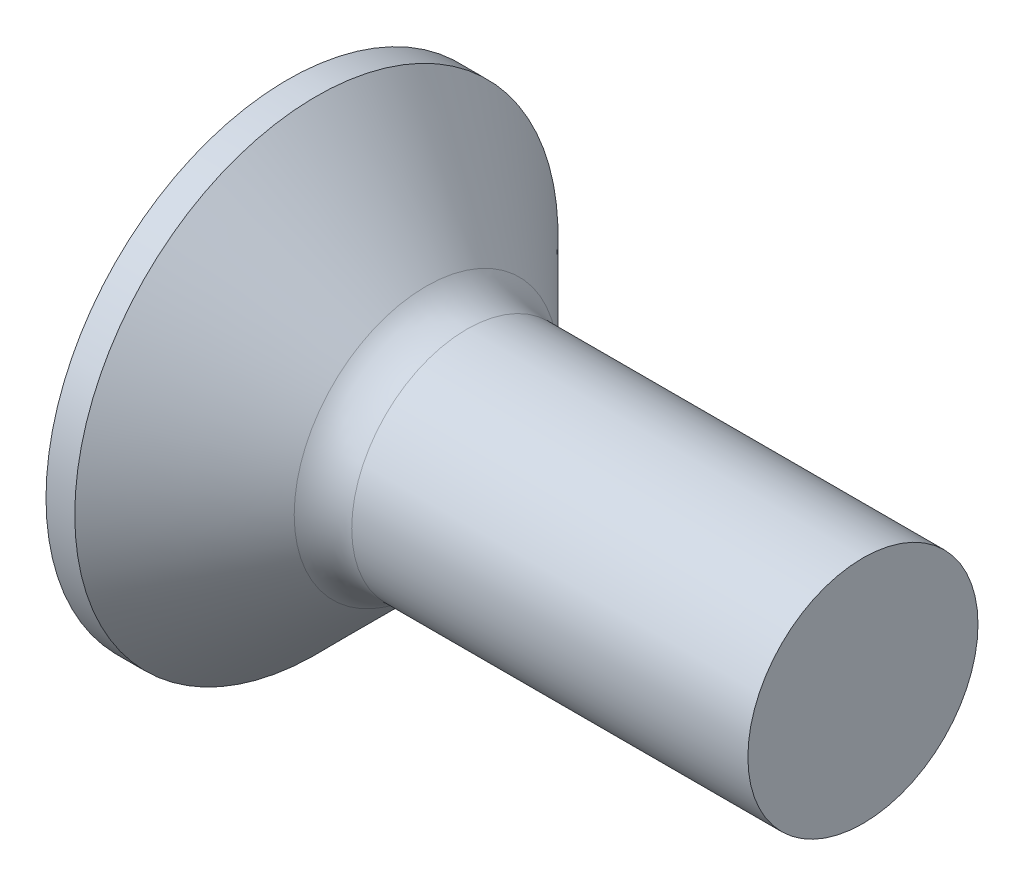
SolidWorks part; units mm, degrees
revolve "Base-Revolve" add sketch "BodySke"
sketch "BodySke" plane through (0, 0, 0) normal (0, 0, 1) x (1, 0, 0)
  line L0 (0, 0) -> (0, 4.2)
  line L1 (0, 4.2) -> (0.5, 4.2)
  line L2 (2.7, 2) -> (10, 2)
  line L3 (10, 2) -> (10, 0)
  line L4 (10, 0) -> (0, 0)
  line L5 (-6.35, 0) -> (82.55, 0) construction
  line L6 (2.7, -2) -> (10, -2) construction
  line L7 (0.5, -4.2) -> (2.7, -2) construction
  line L8 (0.5, 4.2) -> (2.7, 2)
  line L9 (0, -4.2) -> (0.5, -4.2) construction
  line L10 (3.4, 3.5875) -> (3.4, -5.9375) construction
  line L11 (0, 6.35) -> (0, -3.175) construction
fillet "Fillet1" radius 1 1 edges at (2.7, 0, 2)
ref_plane "Plane1" through (0, 0, 0) normal (0, 0, 1) x (1, 0, 0)
ref_plane "Plane2" through (0, 0, 0) normal (0, 1, 0) x (1, 0, 0)
ref_plane "Plane3" through (0, 0, 0) normal (1, 0, 0) x (0, 0, -1)
sketch "Sketch3" plane through (0, 0, 0) normal (-1, 0, 0) x (0, 0, 1)
  line L0 (-0.515, 2.2) -> (0.515, 2.2)
  line L1 (0.515, 2.2) -> (0.515, -2.2)
  line L2 (0.515, -2.2) -> (-0.515, -2.2)
  line L3 (-0.515, -2.2) -> (-0.515, 2.2)
ref_plane "Plane4" through (2.51, 0, 0) normal (-1, 0, 0) x (0, 0, 1)
sketch "Sketch4" plane through (2.51, 0, 0) normal (-1, 0, 0) x (0, 0, 1)
  line L0 (-0.515, 0.9486) -> (0.515, 0.9486)
  line L3 (0.515, 0.9486) -> (0.515, -0.9486)
  line L4 (0.515, -0.9486) -> (-0.515, -0.9486)
  line L5 (-0.515, -0.9486) -> (-0.515, 0.9486)
loft "Recess" cut profiles "Sketch3", "Sketch4"
pattern_circular "RecPat" count 2 every 90 about axis through (0, 0, 0) along (1, 0, 0) of "Recess"
sketch "RecCorSke" plane through (0, 0, 0) normal (0, 0, 1) x (1, 0, 0)
  line L0 (-3.175, 0) -> (15.875, 0) construction
  line L2 (0, 0) -> (0, 1.0265)
  line L3 (0, 1.0265) -> (2.51, 0.851)
  line L4 (2.51, 0.851) -> (2.7865, 0)
  line L5 (2.7865, 0) -> (0, 0)
revolve "RecessCore" cut sketch "RecCorSke" angle 360 about L0
sketch "ThdSchSke" plane through (0, 0, 0) normal (0, 0, 1) x (1, 0, 0)
  line L0 (3.4, -1.61) -> (3.1269, -2)
  line L1 (3.4, -1.61) -> (3.6731, -2)
  line L2 (3.6731, -2) -> (3.6731, -2.5)
  line L3 (-3.175, 0) -> (5.1513, 0) construction
  line L5 (3.6731, -2.5) -> (3.1269, -2.5)
  line L6 (3.1269, -2.5) -> (3.1269, -2)
  line L7 (0, 4.2) -> (0, -4.2) construction
revolve "ThreadSchematic" [suppressed] cut sketch "ThdSchSke" angle 360 about L3
pattern_linear "ThdSchPat" [suppressed]
equation "\"D1@Sketch3\" = \"Cross_dia@Sketch3\" / 2"
equation "\"D2@Sketch3\" = \"Cross_width@Sketch3\" / 2"
equation "\"Depth@RecCorSke\" = \"Cross_depth@Plane4\""
equation "\"D1@Sketch4\" = \"Cross_width@Sketch3\""
equation "\"D2@Sketch4\" = \"Cross_dia@Sketch3\" - 2.0 * \"Cross_depth@Plane4\" * tan(26.5  * 0.017453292)"
equation "\"D3@Sketch4\" = \"D1@Sketch4\" / 2"
equation "\"D4@Sketch4\" = \"D2@Sketch4\" / 2"
equation "\"Thread_length@ThreadCosmetic\" = ((sgn( (\"Length@BodySke\" - \"Advance@BodySke\" * 1.0 - \"Head_ht@BodySke\" ) - \"Thread_nom@BodySke\" )-1)*( (\"Length@BodySke\" - \"Advance@BodySke\" * 1.0 - \"Head_ht@BodySke\" "
equation "\"Thread_minor@ThdSchSke\" = \"Thread_minor@ThreadCosmetic\""
equation "\"Diameter@ThdSchSke\" = \"Diameter@BodySke\""
equation "\"Overcut@ThdSchSke\" = \"Diameter@BodySke\" * 1.25"
equation "\"Start@ThdSchSke\" = 0.000001 + \"Length@BodySke\" - \"Thread_length@ThreadCosmetic\"  '---Countersunk---"
equation "\"Num_threads@ThdSchPat\" = int( \"Thread_length@ThreadCosmetic\" / \"Advance@BodySke\" + 0.999 )  + 1"
equation "\"Advance@ThdSchPat\" = \"Thread_length@ThreadCosmetic\" /  (\"Num_threads@ThdSchPat\" - 1) 'relax it"
